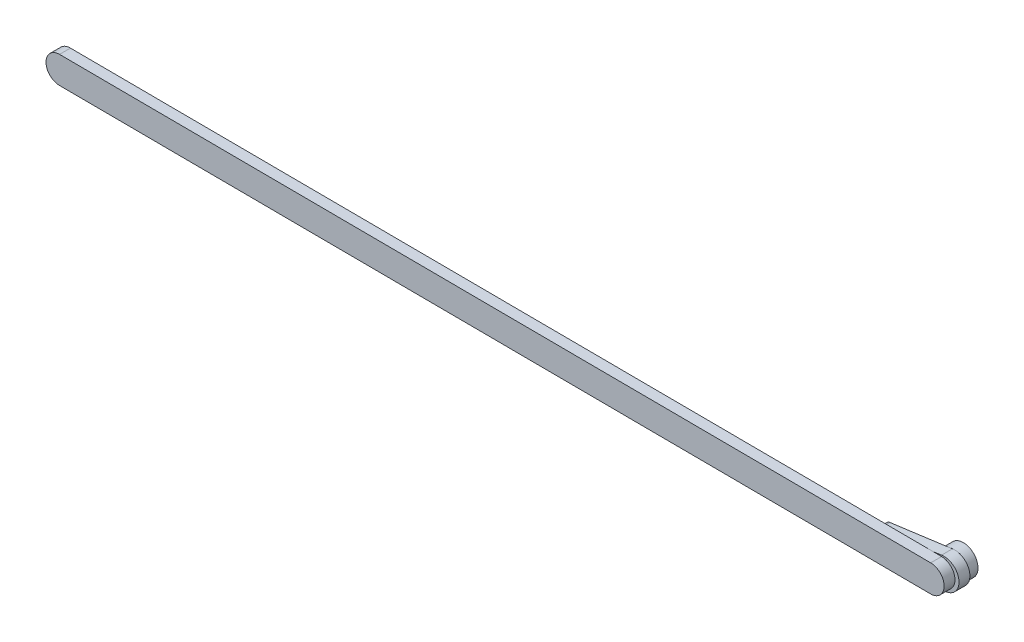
SolidWorks part; units mm, degrees
ref_plane "Front Plane" through (0, 0, 0) normal (0, 0, 1) x (1, 0, 0)
ref_plane "Top Plane" through (0, 0, 0) normal (0, 1, 0) x (1, 0, 0)
ref_plane "Right Plane" through (0, 0, 0) normal (1, 0, 0) x (0, 0, -1)
sketch "Sketch2" plane through (0, 0, 0) normal (0, 0, 1) x (1, 0, 0)
  circle A0 centre (0, 0) radius 1.7145
  dimension "D1" = 3.429
extrude "Boss-Extrude1" add sketch "Sketch2" along normal blind 1.27
sketch "Sketch3" plane through (0, 0, 1.27) normal (0, 0, 1) x (1, 0, 0)
  line L0 (0, 1.7145) -> (-7.2966, 0.7325)
  line L1 (-7.2167, -0.4599) -> (0, -1.7145)
  circle A0 centre (0, 0) radius 1.7145 construction
  arc A1 (-7.2966, 0.7325) -> (-7.2167, -0.4599) centre (-7.2167, 0.139) ccw
  arc A2 (0, -1.7145) -> (0, 1.7145) centre (0.298, 0) ccw
  point P8 (0, 0)
  point P9 (-7.2167, -0.4599)
extrude "Boss-Extrude2" add sketch "Sketch3" along normal blind 1.27
sketch "Sketch4" plane through (0, 0, 2.54) normal (0, 0, 1) x (1, 0, 0)
  line L0 (0, 0) -> (-101.6, 0.5577) construction
  line L1 (-0.0086, -1.5729) -> (-101.6086, -1.0152)
  line L2 (0.0086, 1.5729) -> (-101.5914, 2.1307)
  arc A0 (-0.0086, -1.5729) -> (0.0086, 1.5729) centre (0, 0) ccw
  arc A1 (-101.5914, 2.1307) -> (-101.6086, -1.0152) centre (-101.6, 0.5577) ccw
  point P3 (-50.8, 0.2789)
  dimension "D1" = 101.6
extrude "Boss-Extrude3" add sketch "Sketch4" along normal blind 1.27
